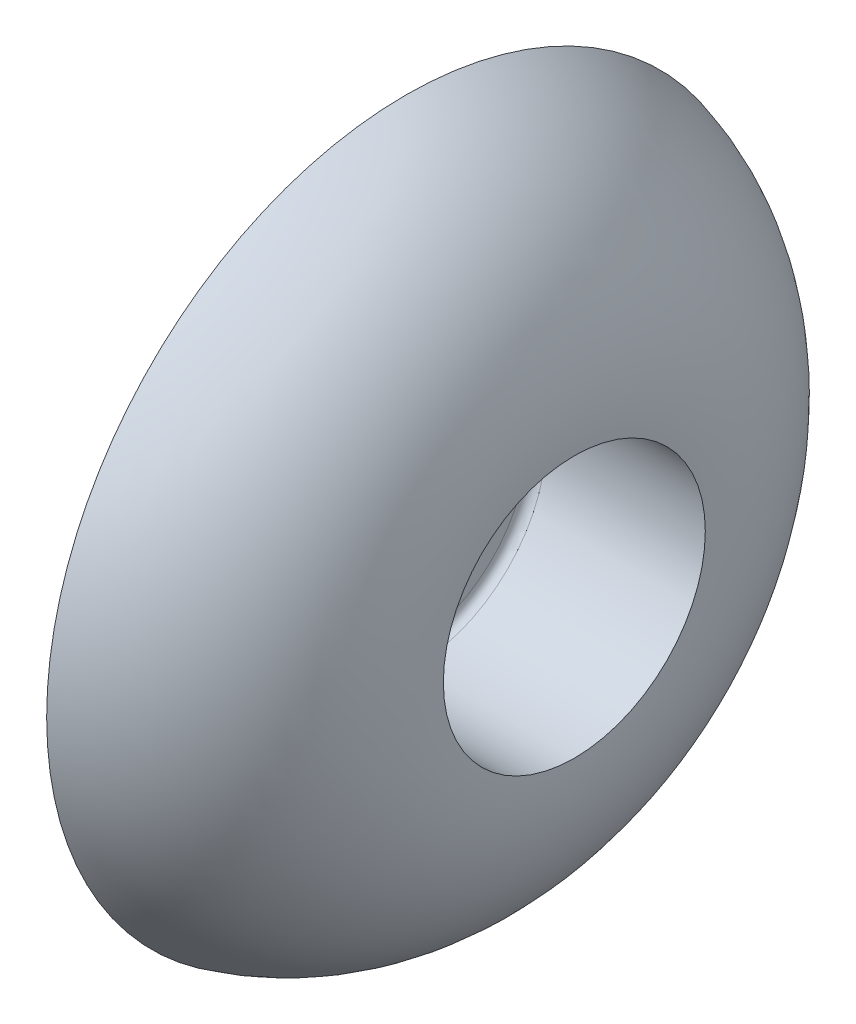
SolidWorks part; units mm, degrees
ref_plane "Plan1" through (0, 0, 0) normal (0, 0, 1) x (1, 0, 0)
ref_plane "Plan2" through (0, 0, 0) normal (0, 1, 0) x (1, 0, 0)
ref_plane "Plan3" through (0, 0, 0) normal (1, 0, 0) x (0, 0, -1)
sketch "Esquisse1" plane through (0, 0, 0) normal (0, 0, 1) x (1, 0, 0)
  line L0 (60, 0) -> (-67, 0) construction
  line L1 (12.4322, 4.5) -> (17.4322, 4.5)
  line L2 (17.4322, 4.5) -> (17.4322, 7)
  line L3 (17.4322, 7) -> (26.4322, 7)
  line L4 (12.4322, 7) -> (14.9322, 7)
  line L5 (14.9322, 7) -> (14.9322, 9.5)
  line L6 (14.9322, 9.5) -> (23.7495, 9.5)
  line L7 (12.4322, 7) -> (12.4322, 4.5)
  line L8 (17.4322, 19.2) -> (17.4322, 16.596)
  arc A0 (17.4322, 19.2) -> (26.4322, 7) centre (14.4461, 7.5775) cw
  arc A1 (17.4322, 16.596) -> (23.7495, 9.5) centre (14.4461, 7.5775) cw
  dimension "D4" = 12
  dimension "D1" = 4.5
  dimension "D2" = 7
  dimension "D3" = 9
  dimension "D5" = 19.2
  dimension "D6" = 14
  dimension "D7" = 2.5
revolve "Base-Révolution" add sketch "Esquisse1" angle 360 about L0
fillet "Congé1" radius 1
fillet "Congé2" radius 2
fillet "Congé3" radius 0.5
